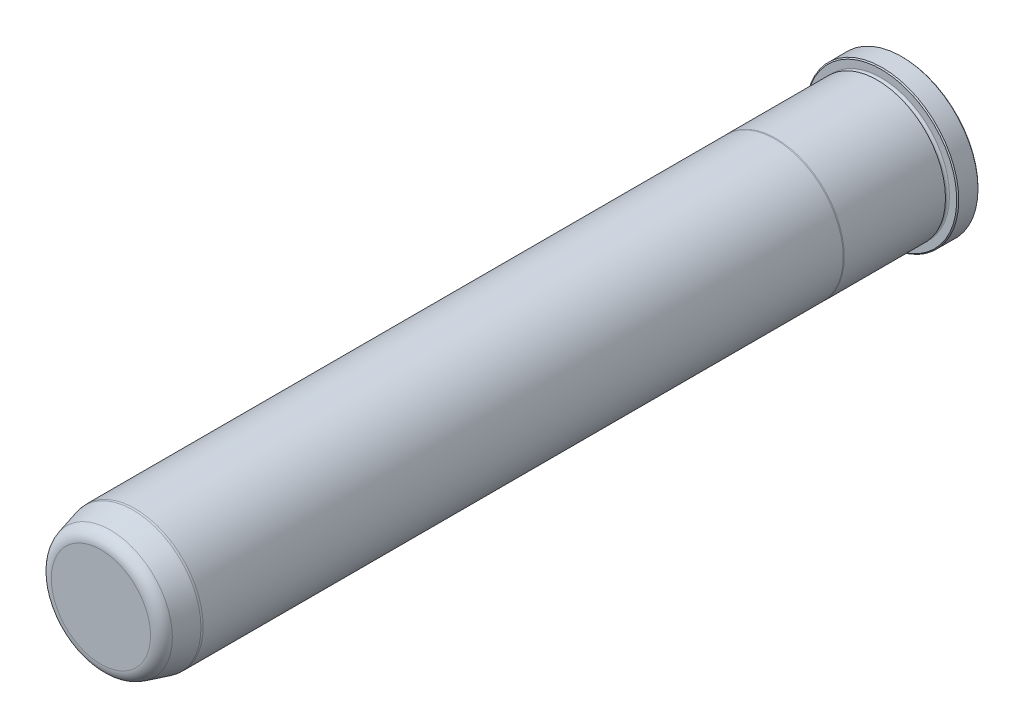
SolidWorks part; units mm, degrees
ref_plane "Front Plane" through (0, 0, 0) normal (0, 0, 1) x (1, 0, 0)
ref_plane "Top Plane" through (0, 0, 0) normal (0, 1, 0) x (1, 0, 0)
ref_plane "Right Plane" through (0, 0, 0) normal (1, 0, 0) x (0, 0, -1)
sketch "Sketch1" plane through (0, 0, 0) normal (1, 0, 0) x (0, 0, -1)
  line L0 (0, 0) -> (0, 28.448)
  line L1 (0, 28.448) -> (-7.9248, 28.448)
  line L2 (-7.9248, 28.448) -> (-7.9248, 25.3873)
  line L3 (-7.9248, 24.6253) -> (-9.4488, 24.6253) construction
  line L4 (-9.4488, 25.3873) -> (-9.4488, 25.4127)
  line L5 (-9.4488, 25.4127) -> (-47.1348, 25.4127)
  line L6 (-47.1348, 25.4127) -> (-47.498, 25.3873)
  line L7 (-47.498, 25.3873) -> (-285.75, 25.3873)
  line L9 (-298.45, 22.1219) -> (-298.45, 0)
  line L10 (-298.45, 0) -> (0, 0)
  line L11 (0, 0) -> (13.6287, 0) construction
  line L12 (-285.75, 25.3873) -> (-286.512, 25.3206)
  line L13 (-286.512, 25.3206) -> (-298.45, 22.1219)
  arc A0 (-9.4488, 25.3873) -> (-7.9248, 25.3873) centre (-8.6868, 25.3873) ccw
  dimension "D14" = 1.524
  dimension "D1" = 7.9248
  dimension "D2" = 1.524
  dimension "D3" = 56.896
  dimension "D4" = 50.8254
  dimension "D5" = 47.498
  dimension "D6" = 298.45
  dimension "D7" = 0.7874
  dimension "D8" = 4
  dimension "D9" = 50.7746
  dimension "D10" = 5
  dimension "D11" = 15
  dimension "D12" = 0.762
  dimension "D13" = 12.7
revolve "Revolve1" add sketch "Sketch1" angle 360 about L11
fillet "Fillet6" radius 4.7625 1 edges at (22.1219, 0, 298.45)
chamfer "Chamfer1" distance 0.381 angle 45 2 edges at (28.448, 0, 0) (28.448, 0, 7.9248)
